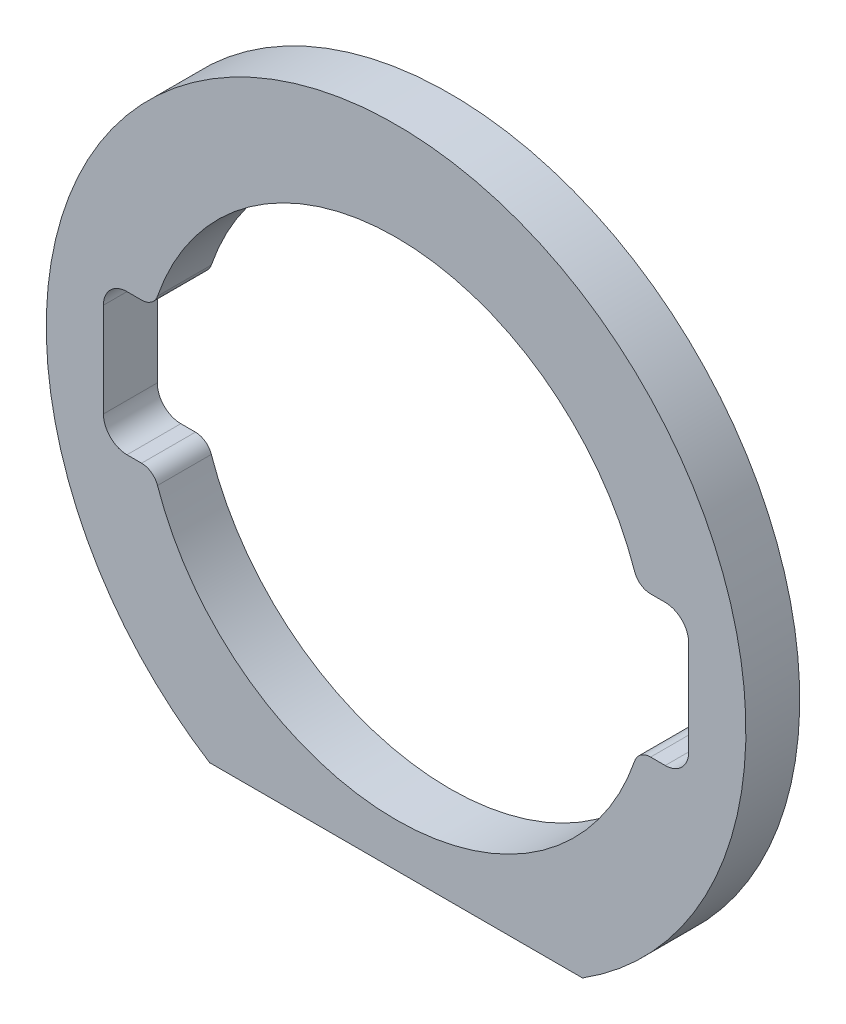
SolidWorks part; units mm, degrees
ref_plane "Спереди" through (0, 0, 0) normal (0, 0, 1) x (1, 0, 0)
ref_plane "Сверху" through (0, 0, 0) normal (0, 1, 0) x (1, 0, 0)
ref_plane "Справа" through (0, 0, 0) normal (1, 0, 0) x (0, 0, -1)
sketch "Эскиз1" plane through (0, 0, 0) normal (0, 0, 1) x (1, 0, 0)
  line L1 (-27.7128, -44) -> (27.7128, -44)
  arc A0 (27.7128, -44) -> (-27.7128, -44) centre (0, 0) ccw
  dimension "D1" = 104
extrude "Бобышка-Вытянуть1" add sketch "Эскиз1" along normal blind 8
sketch "Эскиз2" plane through (0, 0, 8) normal (0, 0, 1) x (1, 0, 0)
  line L0 (-43, 7) -> (-43, -7) construction
  line L1 (43, 7) -> (43, -7) construction
  line L2 (37.8286, 10) -> (40, 10) construction
  line L3 (-40, 10) -> (-37.8286, 10) construction
  line L4 (-40, 10.5) -> (-37.8286, 10.5)
  line L5 (-40, -10) -> (-37.8286, -10) construction
  line L6 (-43.5, 7) -> (-43.5, -7)
  line L7 (-40, -10.5) -> (-37.8286, -10.5)
  line L8 (37.8286, -10.5) -> (40, -10.5)
  line L9 (37.8286, -10) -> (40, -10) construction
  line L10 (43.5, 7) -> (43.5, -7)
  line L11 (37.8286, 10.5) -> (40, 10.5)
  arc A0 (-34.9914, -12.025) -> (34.9914, -12.025) centre (0, 0) ccw construction
  arc A1 (34.9914, 12.025) -> (-34.9914, 12.025) centre (0, 0) ccw construction
  arc A2 (-40, 10) -> (-43, 7) centre (-40, 7) ccw construction
  arc A3 (-40, -10) -> (-43, -7) centre (-40, -7) cw construction
  arc A4 (-34.9914, -12.025) -> (-37.8286, -10) centre (-37.8286, -13) ccw construction
  arc A5 (-37.8286, 10) -> (-34.9914, 12.025) centre (-37.8286, 13) ccw construction
  arc A6 (34.9914, 12.025) -> (37.8286, 10) centre (37.8286, 13) ccw construction
  arc A7 (34.9914, -12.025) -> (37.8286, -10) centre (37.8286, -13) cw construction
  arc A8 (40, -10) -> (43, -7) centre (40, -7) ccw construction
  arc A9 (40, 10) -> (43, 7) centre (40, 7) cw construction
  arc A10 (35.4643, 12.1875) -> (-35.4643, 12.1875) centre (0, 0) ccw
  arc A11 (-37.8286, 10.5) -> (-35.4643, 12.1875) centre (-37.8286, 13) ccw
  arc A12 (-40, 10.5) -> (-43.5, 7) centre (-40, 7) ccw
  arc A13 (-40, -10.5) -> (-43.5, -7) centre (-40, -7) cw
  arc A14 (-35.4643, -12.1875) -> (-37.8286, -10.5) centre (-37.8286, -13) ccw
  arc A15 (-35.4643, -12.1875) -> (35.4643, -12.1875) centre (0, 0) ccw
  arc A16 (35.4643, -12.1875) -> (37.8286, -10.5) centre (37.8286, -13) cw
  arc A17 (40, -10.5) -> (43.5, -7) centre (40, -7) ccw
  arc A18 (40, 10.5) -> (43.5, 7) centre (40, 7) cw
  arc A19 (35.4643, 12.1875) -> (37.8286, 10.5) centre (37.8286, 13) ccw
  point P20 (35.623, 10)
  point P23 (35.623, -10)
  dimension "D1" = 3
  dimension "D2" = 3
  dimension "D3" = 3
  dimension "D4" = 3
  dimension "D5" = 3
  dimension "D6" = 3
  dimension "D7" = 3
  dimension "D8" = 0.5
extrude "Вырез-Вытянуть1" cut sketch "Эскиз2" against normal blind 10
